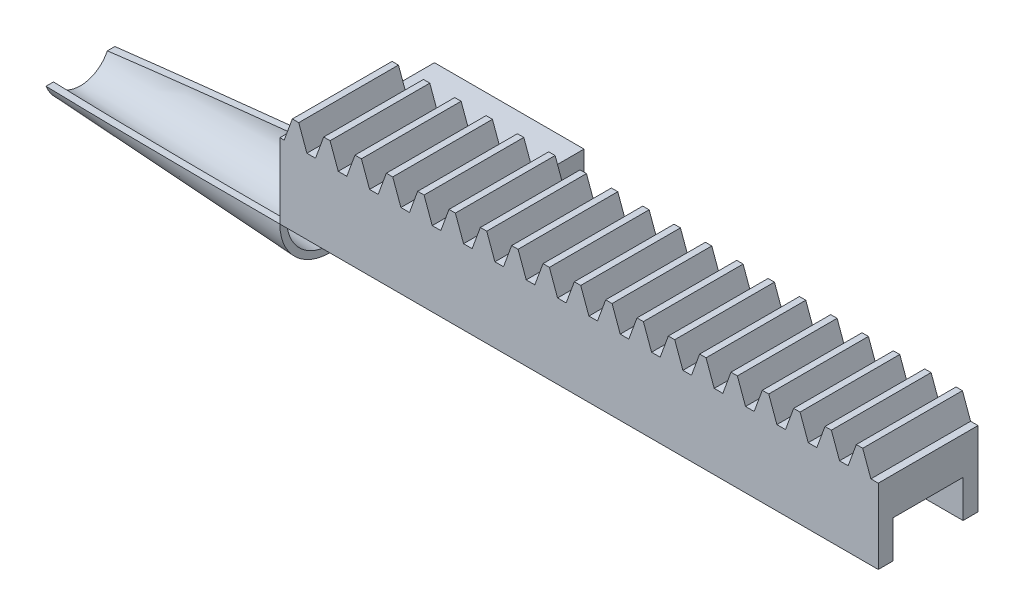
SolidWorks part; units mm, degrees
extrude "Blank" add sketch "BlankSke" against normal blind 20
sketch "BlankSke" plane through (0, 0, 0) normal (0, 0, 1) x (1, 0, 0)
  line L1 (0, 0) -> (120, 0)
  line L2 (0, 0) -> (0, 12)
  line L3 (0, 12) -> (120, 12)
  line L4 (120, 0) -> (120, 12)
ref_plane "Plane1" through (0, 0, 0) normal (0, 0, 1) x (1, 0, 0)
ref_plane "Plane2" through (0, 0, 0) normal (0, 1, 0) x (1, 0, 0)
ref_plane "Plane3" through (0, 0, 0) normal (1, 0, 0) x (0, 0, -1)
other "Configuration Table"
sketch "HoldingSke" plane through (0, 0, 0) normal (0, 1, 0) x (1, 0, 0)
  line L0 (0, 0) -> (0.0696, 0.4951)
  line L1 (-15, 0) -> (100, 0) construction
  line L2 (0, 0) -> (-2.1039, 2.3779)
  line L3 (0, 0) -> (-11.863, 4.5341)
  line L4 (0, 0) -> (8.0624, 3.0949)
  line L5 (0, 0) -> (-23.7986, -8.8762)
  line L6 (0, 0) -> (-10.5278, -7.1032)
  line L9 (-71.009, 38.7566) -> (41.7541, 79.799)
  line L10 (-76.2, 4.3779) -> (-66.2, 4.3779)
  line L11 (0, 0) -> (-10, 0)
  line L12 (-76.2, 101.6) -> (-76.133, 101.6)
  line L13 (24.9733, 27.94) -> (52.9518, 28.4284)
  line L14 (24.9733, 27.94) -> (24.9743, 27.94)
  line L15 (24.9733, 27.94) -> (100.4006, 29.5858)
  circle A0 centre (0, 0) radius 19.05
  circle A1 centre (0, 0) radius 5
  circle A2 centre (0, 0) radius 12.7
sketch "TooCutSkeIll" plane through (0, 0, 0) normal (0, 0, 1) x (1, 0, 0)
  line L0 (-2.4806, 11.9474) -> (-0.9819, 7.8296)
  line L1 (-0.5111, 7.5) -> (0.5111, 7.5)
  line L2 (0.9819, 7.8296) -> (2.4806, 11.9474)
  line L3 (120, 12) -> (0, 12) construction
  line L4 (0, 0) -> (0, 64.897) construction
  line L5 (-13.208, 10) -> (12.954, 10) construction
  line L6 (0, 0) -> (120, 0) construction
  line L7 (1.7718, 10) -> (1.7718, 48.7463) construction
  line L8 (-1.7718, 10) -> (-1.7718, 48.7463) construction
  line L9 (2.5558, 12) -> (2.5558, 12.0254)
  line L10 (-2.5558, 12) -> (-2.5558, 12.0254)
  line L11 (-2.5558, 12.0254) -> (2.5558, 12.0254)
  arc A0 (0.5111, 7.5) -> (0.9819, 7.8296) centre (0.5111, 8.001) ccw
  arc A1 (-0.9819, 7.8296) -> (-0.5111, 7.5) centre (-0.5111, 8.001) ccw
  arc A2 (2.5558, 12) -> (2.4806, 11.9474) centre (2.5558, 11.92) ccw
  arc A3 (-2.4806, 11.9474) -> (-2.5558, 12) centre (-2.5558, 11.92) ccw
extrude "ToothCutIll" [suppressed] cut sketch "TooCutSkeIll" against normal through all
sketch "TooCutSkeSim" plane through (0, 0, 0) normal (0, 0, 1) x (1, 0, 0)
  line L0 (0.8619, 7.5) -> (-0.8619, 7.5)
  line L1 (2.509, 12.0254) -> (0.8619, 7.5)
  line L2 (0, 17.4625) -> (0, 53.467) construction
  line L3 (2.509, 12.0254) -> (-2.509, 12.0254)
  line L6 (-2.509, 12.0254) -> (-0.8619, 7.5)
  line L9 (-1.7718, 10) -> (1.7718, 10) construction
  line L10 (0, 0) -> (120, 0) construction
  line L11 (1.7718, 10) -> (1.7718, 53.467) construction
  line L12 (-1.7718, 10) -> (-1.7718, 53.467) construction
extrude "ToothCutSim" cut sketch "TooCutSkeSim" against normal through all
pattern_linear "TeethCuts" count 20 spacing 6.2832 along (1, 0, 0) of "ToothCutIll", "ToothCutSim"
sketch "草图1" plane through (0, 0, 0) normal (0, -1, 0) x (1, 0, 0)
  line L0 (120, -20) -> (0, -20)
  line L1 (0, -20) -> (0, -17)
  line L2 (0, -20) -> (0, 0) construction
  line L3 (0, -17) -> (120, -17)
  line L4 (120, -20) -> (120, 0) construction
  line L5 (120, -17) -> (120, -20)
  line L6 (120, -10) -> (0, -10) construction
  line L7 (0, -3) -> (120, -3)
  line L8 (0, 0) -> (0, -3)
  line L9 (120, 0) -> (0, 0)
  line L10 (120, -3) -> (120, 0)
  dimension "D1" = 3
extrude "凸台-拉伸1" add sketch "草图1" along normal blind 7.5
sketch "草图3" plane through (0, 0, 0) normal (-1, 0, 0) x (0, 0, 1)
  line L0 (0, -7.5) -> (-29.3324, -7.5) construction
  line L1 (-10, 12) -> (-10, -30.8459) construction
  line L2 (0, 12) -> (-20, 12) construction
  line L3 (-20, -7.5) -> (0, -7.5) construction
  line L5 (-20, -7.5) -> (0, -7.5)
  arc A0 (-20, -7.5) -> (0, -7.5) centre (-10, -7.5) ccw
extrude "凸台-拉伸2" add sketch "草图3" along normal blind 50 draft 3 separate body
sketch "草图4" plane through (-50, 0, 0) normal (-1, 0, 0) x (0, 0, 1)
  line L0 (0, -7.5) -> (-20, -7.5) construction
  line L1 (-16, -7.5) -> (-4, -7.5)
  arc A0 (-16, -7.5) -> (-4, -7.5) centre (-10, -7.5) ccw
  dimension "D1" = 12
extrude "切除-拉伸1" cut sketch "草图4" against normal blind 50 draft 3
sketch "草图5" plane through (0, 0, 0) normal (-1, 0, 0) x (0, 0, 1)
  line L0 (-20, 0.0192) -> (-20, 5.0192)
  line L2 (-20, 7.5) -> (-20, -7.5) construction
  line L3 (-20, 5.0192) -> (-31, 5.0192)
  line L4 (-31, 0.0192) -> (-31, 8.5192) construction
  line L5 (-20, 0.0192) -> (-24, 0.0192) construction
  line L6 (-31, 5.0192) -> (-31, -3.4808)
  line L7 (-31, -3.4808) -> (-24, -3.4808)
  line L8 (-24, -3.4808) -> (-24, 0.0192)
  line L9 (-24, 0.0192) -> (-20, 0.0192)
  dimension "D1" = 5
extrude "凸台-拉伸3" add sketch "草图5" against normal blind 30
equation "' \"Module@HoldingSke\" = 6.35"
equation "' \"Num_teeth@HoldingSke\" = 12"
equation "' \"Ap@HoldingSke\" =  20"
equation "' \"Ap@HoldingSke\" = 20"
equation "' \"Width@HoldingSke\" = 0.25 * 25.4"
equation "' \"Show_teeth@HoldingSke\" = 500"
equation "' \"Backlash@HoldingSke\" = 0.009 * 25.4"
equation "' \"Addendum_fac@HoldingSke\" = 1.0"
equation "' \"Dedendum_fac@HoldingSke\" = 1.25"
equation "' \"Dedendum_add@HoldingSke\" = 0.00005 * 25.4"
equation "' \"Clearance_fac@HoldingSke\" = 0.25"
equation "' \"Pitch_height@HoldingSke\" = 1 * 25.4"
equation "' \"Length@HoldingSke\" = 4.71 * 25.4"
equation "\"Pitch@HoldingSke\" = 1 / \"Module@HoldingSke\""
equation "\"MPH@HoldingSke\" = \"Dedendum_fac@HoldingSke\" / \"Pitch@HoldingSke\" + 2 * \"Dedendum_add@HoldingSke\" + 0.002 * 25.4"
equation "\"MPH@HoldingSke\" = ((sgn( \"MPH@HoldingSke\" - \"Pitch_height@HoldingSke\")+1)*( \"MPH@HoldingSke\" - \"Pitch_height@HoldingSke\"))/2 + \"Pitch_height@HoldingSke\""
equation "\"Blank_height@BlankSke\" = \"Pitch_height@HoldingSke\" + \"Addendum_fac@HoldingSke\"  / \"Pitch@HoldingSke\" "
equation "\"Length@BlankSke\" =  \"Length@HoldingSke\""
equation "\"Pressure_angle@TooCutSkeIll\" = \"Ap@HoldingSke\""
equation "\"Addendum_plus@TooCutSkeIll\" =  \"Addendum_fac@HoldingSke\"  / \"Pitch@HoldingSke\" + 0.001 *25.4"
equation "\"Dedendum@TooCutSkeIll\" = \"Dedendum_fac@HoldingSke\"  / \"Pitch@HoldingSke\""
equation "\"Pitch_height@TooCutSkeIll\" =  \"MPH@HoldingSke\""
equation "\"Gap_width@TooCutSkeIll\" = 3.14159265 / 2 / \"Pitch@HoldingSke\" + 6 * \"Backlash@HoldingSke\""
equation "\"Pressure_angle@TooCutSkeSim\" = \"Ap@HoldingSke\""
equation "\"Addendum_plus@TooCutSkeSim\" =  \"Addendum_fac@HoldingSke\"  / \"Pitch@HoldingSke\" + 0.001 * 25.4"
equation "\"Dedendum@TooCutSkeSim\" = \"Dedendum_fac@HoldingSke\"  / \"Pitch@HoldingSke\""
equation "\"Pitch_height@TooCutSkeSim\" =  \"MPH@HoldingSke\""
equation "\"Gap_width@TooCutSkeSim\" = 3.14159265 / 2 / \"Pitch@HoldingSke\" + 6 * \"Backlash@HoldingSke\""
equation "\"Root_fillet@TooCutSkeIll\" = \"Clearance_fac@HoldingSke\" / \"Pitch@HoldingSke\" + \"Dedendum_add@HoldingSke\""
equation "\"Break_rad@TooCutSkeIll\" = 0.02 / \"Pitch@HoldingSke\" * 2"
equation "\"Linear_pitch@TeethCuts\" = 3.14159265 / \"Pitch@HoldingSke\""
equation "\"Num_teeth@HoldingSke\" = int( ( \"Length@HoldingSke\" + 0 ) / (3.14159265 / \"Pitch@HoldingSke\")) + 0.9999  + 1"
equation " \"Num_teeth@TeethCuts\" = int( \"Show_teeth@HoldingSke\" ) + 1"
equation " \"Num_teeth@TeethCuts\" = ((sgn( \"Num_teeth@TeethCuts\" - \"Num_teeth@HoldingSke\" )-1)*( \"Num_teeth@TeethCuts\" - \"Num_teeth@HoldingSke\" ))/-2+ \"Num_teeth@HoldingSke\""
equation " \"Num_teeth@TeethCuts\" = ((sgn( \"Num_teeth@TeethCuts\" - 2.0)+1)*( \"Num_teeth@TeethCuts\" - 2.0))/2 +2.0"
